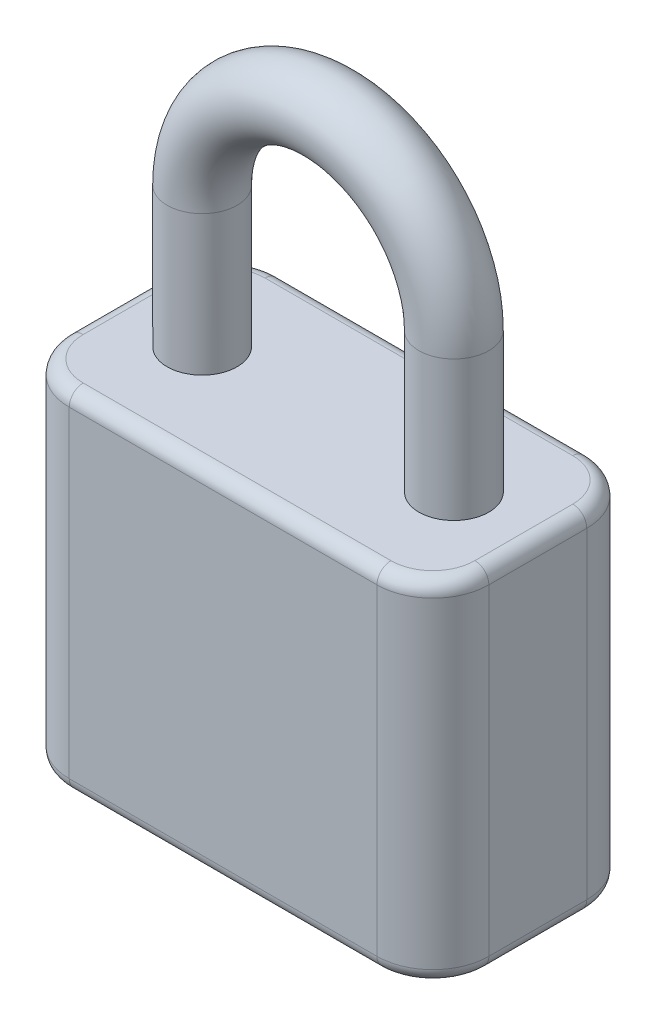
SolidWorks part; units mm, degrees
ref_plane "Front Plane" through (0, 0, 0) normal (0, 0, 1) x (1, 0, 0)
ref_plane "Top Plane" through (0, 0, 0) normal (0, 1, 0) x (1, 0, 0)
ref_plane "Right Plane" through (0, 0, 0) normal (1, 0, 0) x (0, 0, -1)
sketch "Sketch1" plane through (0, 0, 0) normal (0, 1, 0) x (1, 0, 0)
  line L1 (-38.1, -19.05) -> (38.1, -19.05)
  line L2 (-38.1, -19.05) -> (-38.1, 19.05)
  line L3 (-38.1, 19.05) -> (38.1, 19.05)
  line L4 (38.1, -19.05) -> (38.1, 19.05)
  line L5 (-38.1, -19.05) -> (38.1, 19.05) construction
  line L6 (-38.1, 19.05) -> (38.1, -19.05) construction
  point P0 (0, 0)
  dimension "D1" = 76.2
  dimension "D2" = 38.1
extrude "Boss-Extrude1" add sketch "Sketch1" along normal blind 63.5
fillet "Fillet1" radius 10.16 4 edges at (38.1, 31.75, -19.05) (-38.1, 31.75, -19.05) (-38.1, 31.75, 19.05) (38.1, 31.75, 19.05)
fillet "Fillet2" radius 2.54 16 edges at (-35.1242, 0, 16.0742) (-38.1, 0, 0) (-35.1242, 0, -16.0742) (0, 0, -19.05) (35.1242, 0, -16.0742) (38.1, 0, 0) (35.1242, 0, 16.0742) (-35.1242, 63.5, 16.0742) (-38.1, 63.5, 0) (-35.1242, 63.5, -16.0742) (0, 63.5, -19.05) (35.1242, 63.5, -16.0742) (38.1, 63.5, 0) (35.1242, 63.5, 16.0742) (0, 0, 19.05) (0, 63.5, 19.05)
sketch "Sketch2" plane through (0, 63.5, 0) normal (0, 1, 0) x (1, 0, 0)
  line L0 (-35.56, 8.89) -> (-35.56, -8.89) construction
  line L1 (35.56, -8.89) -> (35.56, 8.89) construction
  circle A0 centre (-22.86, 0) radius 6.35
  point P4 (22.86, 0)
  dimension "D1" = 12.7
  dimension "D2" = 12.7
  dimension "D3" = 12.7
sketch3d "3DSketch2"
  line L0 (-22.86, 63.5, 0) -> (-22.86, 88.9, 0)
  line L2 (22.86, 88.9, 0) -> (22.86, 63.5, 0)
  arc A0 (-22.86, 88.9, 0) -> (22.86, 88.9, 0) centre (0, 88.9, 0) cw
  point P7 (0, 88.9, -22.86)
  dimension "D1" = 25.4
sweep "Sweep1" add profiles "Sketch2" path "3DSketch2"
sketch "Sketch3" plane through (0, 0, 0) normal (0, -1, 0) x (1, 0, 0)
  circle A0 centre (0, 0) radius 15.24
  dimension "D1" = 30.48
extrude "Boss-Extrude2" add sketch "Sketch3" along normal blind 1.27
sketch "Sketch4" plane through (0, -1.27, 0) normal (0, -1, 0) x (1, 0, 0)
  point P0 (0, 0)
sketch "Sketch21" plane through (-0.0647, -1.27, -1.1078) normal (0, -1, 0) x (-1, 0, 0)
  line L0 (-0.0647, 3.9722) -> (-0.0647, -6.1878) construction
  line L1 (1.8403, 3.9722) -> (1.8403, -6.1878)
  line L2 (-1.9697, 3.9722) -> (-1.9697, -6.1878)
  arc A0 (1.8403, 3.9722) -> (-1.9697, 3.9722) centre (-0.0647, 3.9722) ccw
  arc A1 (-1.9697, -6.1878) -> (1.8403, -6.1878) centre (-0.0647, -6.1878) ccw
  circle A2 centre (-0.0647, -6.1878) radius 3.81
  circle A3 centre (-0.0647, -1.1078) radius 15.24 construction
  point P3 (-0.0647, -1.1078)
  dimension "D3" = 7.62
  dimension "D1" = 10.16
  dimension "D2" = 3.81
extrude "Cut-Extrude1" cut sketch "Sketch21" against normal blind 25.4
other "Filleted Keyway<1>"
